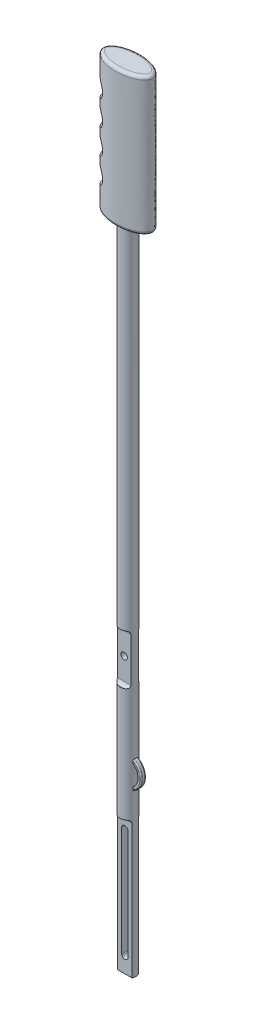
SolidWorks part; units mm, degrees
ref_plane "Front Plane" through (0, 0, 0) normal (0, 0, 1) x (1, 0, 0)
ref_plane "Top Plane" through (0, 0, 0) normal (0, 1, 0) x (1, 0, 0)
ref_plane "Right Plane" through (0, 0, 0) normal (1, 0, 0) x (0, 0, -1)
ref_plane "Plane1" through (0, 0, 0) normal (0, 1, 0) x (1, 0, 0)
sketch "Sketch1" plane through (0, 0, 0) normal (0, 1, 0) x (1, 0, 0)
  circle A0 centre (0, 0) radius 7.9375
extrude "Extrude1" add sketch "Sketch1" along normal blind 635 and the other way blind 25.4
ref_plane "Plane2" through (0, 0, 0) normal (1, 0, 0) x (0, 0, -1)
sketch "Sketch2" plane through (0, 0, 0) normal (1, 0, 0) x (0, 0, -1)
  line L0 (-7.1437, 279.4) -> (-7.9375, 279.4)
  line L1 (-7.9375, 279.4) -> (-7.9375, 228.6)
  line L2 (-7.9375, 228.6) -> (-7.1437, 228.6)
  line L3 (-3.9688, 231.775) -> (-3.9688, 276.225)
  line L4 (7.1437, 279.4) -> (7.9375, 279.4)
  line L5 (7.9375, 279.4) -> (7.9375, 228.6)
  line L6 (7.9375, 228.6) -> (7.1437, 228.6)
  line L7 (3.9688, 231.775) -> (3.9688, 276.225)
  line L8 (-8.7312, 254) -> (8.7312, 254) construction
  arc A0 (-3.9688, 276.225) -> (-7.1437, 279.4) centre (-7.1437, 276.225) ccw
  arc A1 (7.1437, 279.4) -> (3.9688, 276.225) centre (7.1437, 276.225) ccw
  arc A2 (3.9688, 231.775) -> (7.1437, 228.6) centre (7.1437, 231.775) ccw
  arc A3 (-7.1437, 228.6) -> (-3.9688, 231.775) centre (-7.1437, 231.775) ccw
  point P0 (0, 254)
extrude "Cut-Extrude1" cut sketch "Sketch2" against normal mid plane 25.4
ref_plane "Plane3" through (0, 0, 0) normal (0, 0, 1) x (1, 0, 0)
sketch "Sketch3" plane through (0, 0, 0) normal (0, 0, 1) x (1, 0, 0)
  line L0 (0, -13.97) -> (0, 293.37) construction
  circle A0 centre (0, 254) radius 3.302
  point P0 (0, 0)
extrude "Cut-Extrude2" cut sketch "Sketch3" against normal mid plane 25.4
ref_plane "Plane4" through (0, 0, 0) normal (1, 0, 0) x (0, 0, -1)
sketch "Sketch4" plane through (0, 0, 0) normal (1, 0, 0) x (0, 0, -1)
  line L0 (-7.9375, -25.524) -> (-3.1638, -25.524)
  line L1 (-3.1638, -25.524) -> (-3.2233, 110.1929)
  line L2 (-6.3983, 113.3679) -> (-7.9375, 113.3679)
  line L3 (-7.9375, 113.3679) -> (-7.9375, -25.524)
  line L4 (7.9375, -25.6765) -> (3.175, -25.6765)
  line L5 (3.175, -25.6765) -> (3.175, 110.1929)
  line L6 (6.35, 113.3679) -> (7.9375, 113.3679)
  line L7 (7.9375, 113.3679) -> (7.9375, -25.6765)
  line L8 (0, -5.08) -> (0, 106.68) construction
  arc A0 (-3.2233, 110.1929) -> (-6.3983, 113.3679) centre (-6.3983, 110.1929) ccw
  arc A1 (6.35, 113.3679) -> (3.175, 110.1929) centre (6.35, 110.1929) ccw
  point P5 (0, 0)
extrude "Cut-Extrude3" cut sketch "Sketch4" against normal mid plane 25.4
ref_plane "Plane5" through (0, 0, 0) normal (0, 0, 1) x (1, 0, 0)
sketch "Sketch5" plane through (0, 0, 0) normal (0, 0, 1) x (1, 0, 0)
  line L0 (3.175, 101.6) -> (3.175, -9.525)
  line L1 (-3.175, -9.525) -> (-3.175, 101.6)
  line L2 (0, -18.1542) -> (0, 88.3444) construction
  arc A0 (-3.175, -9.525) -> (3.175, -9.525) centre (0, -9.525) ccw
  arc A1 (3.175, 101.6) -> (-3.175, 101.6) centre (0, 101.6) ccw
  point P4 (0, 0)
  dimension "D5" = 3.175
  dimension "D1" = 6.35
  dimension "D2" = 9.525
  dimension "D3" = 101.6
extrude "Cut-Extrude4" cut sketch "Sketch5" against normal mid plane 25.4
ref_plane "Plane6" through (0, 0, 0) normal (0, 0, 1) x (1, 0, 0)
ref_plane "Plane7" through (0, 0, 0) normal (0, 0, 1) x (1, 0, 0)
sketch "Sketch9" plane through (0, 635, 0) normal (0, 1, 0) x (1, 0, 0)
  ellipse E0 centre (0, 0) end of major axis (-25.4, 0) minor radius 12.7
  dimension "D1" = 25.4
  dimension "D2" = 12.7
extrude "Extrude2" add sketch "Sketch9" along normal blind 139.7
sketch "Sketch8" plane through (0, 0, 0) normal (0, 0, 1) x (1, 0, 0)
  line L0 (-25.4, 803.6754) -> (-25.4, 905.8402) construction
  line L1 (-25.4, 635) -> (25.4, 635) construction
  line L2 (-25.4, 774.7) -> (-25.4, 635) construction
  circle A0 centre (-25.4, 742.95) radius 9.525
  circle A1 centre (-25.4, 717.55) radius 9.525
  circle A2 centre (-25.4, 692.15) radius 9.525
  circle A3 centre (-25.4, 666.75) radius 9.525
  dimension "D5" = 19.05
  dimension "D1" = 31.75
  dimension "D2" = 25.4
  dimension "D3" = 25.4
  dimension "D4" = 25.4
extrude "Cut-Extrude6" cut sketch "Sketch8" against normal mid plane 222.758
fillet "Fillet1" radius 3.175 2 edges at (-25.4, 635, 0) (-25.4, 774.7, 0)
ref_point "Point1" parameters "D1"=2.54
sketch "Sketch10" plane through (0, 0, 0) normal (0, 0, 1) x (1, 0, 0)
  line L0 (0.0809, 165.0997) -> (0.0809, 168.2748)
  line L1 (0.0809, 139.7003) -> (0.0809, 136.5252)
  arc A0 (0.0809, 165.0997) -> (0.0809, 139.7003) centre (0, 152.4) cw
  arc A1 (0.0809, 168.2748) -> (0.0809, 136.5252) centre (0, 152.4) cw
  dimension "D2" = 12.7
  dimension "D3" = 15.875
  dimension "D1" = 152.4
extrude "Extrude3" add sketch "Sketch10" along normal blind 2.54 and the other way blind 2.54
fillet "Fillet2" radius 1.27 2 edges at (15.875, 152.4, -2.54) (15.875, 152.4, 2.54)
